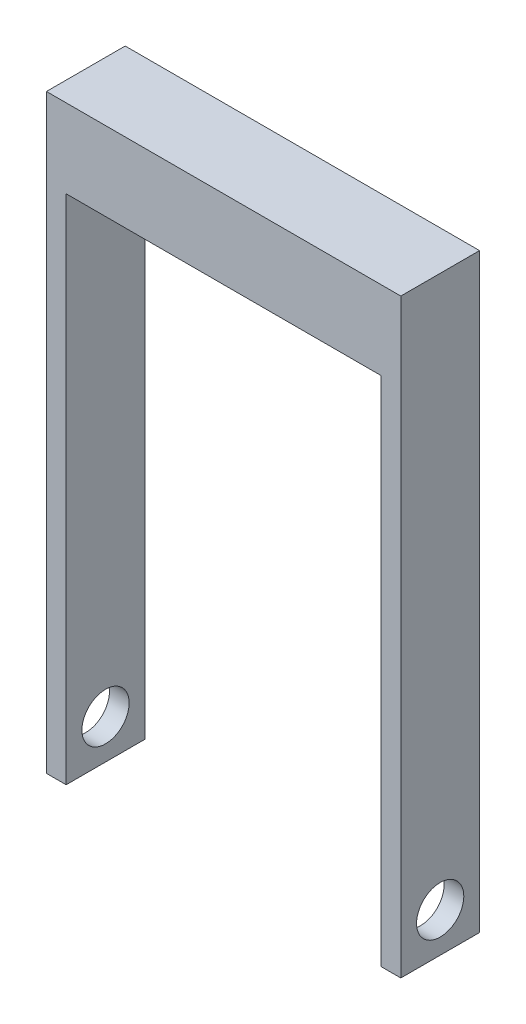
SolidWorks part; units mm, degrees
ref_plane "Piano frontale" through (0, 0, 0) normal (0, 0, 1) x (1, 0, 0)
ref_plane "Piano superiore" through (0, 0, 0) normal (0, 1, 0) x (1, 0, 0)
ref_plane "Piano destro" through (0, 0, 0) normal (1, 0, 0) x (0, 0, -1)
sketch "Schizzo1" plane through (0, 0, 0) normal (0, 0, 1) x (1, 0, 0)
  line L0 (-45, 0) -> (-45, 150)
  line L1 (-45, 150) -> (45, 150)
  line L2 (45, 150) -> (45, 0)
  line L3 (-45, 0) -> (-40, 0)
  line L4 (-40, 0) -> (-40, 130)
  line L5 (-40, 130) -> (40, 130)
  line L6 (40, 130) -> (40, 0)
  line L7 (40, 0) -> (45, 0)
  line L8 (0, 130) -> (0, 150) construction
  line L9 (0, 130) -> (0, 0) construction
  dimension "D1" = 5
  dimension "D2" = 150
  dimension "D3" = 90
  dimension "D4" = 20
extrude "Estrusione1" add sketch "Schizzo1" along normal blind 20
sketch "Schizzo2" plane through (45, 0, 0) normal (1, 0, 0) x (0, 0, -1)
  line L0 (-10, 0) -> (-10, 10) construction
  line L1 (-20, 0) -> (0, 0) construction
  circle A0 centre (-10, 10) radius 6
  dimension "D1" = 12
  dimension "D2" = 10
extrude "Estrusione2" cut sketch "Schizzo2" against normal through all
